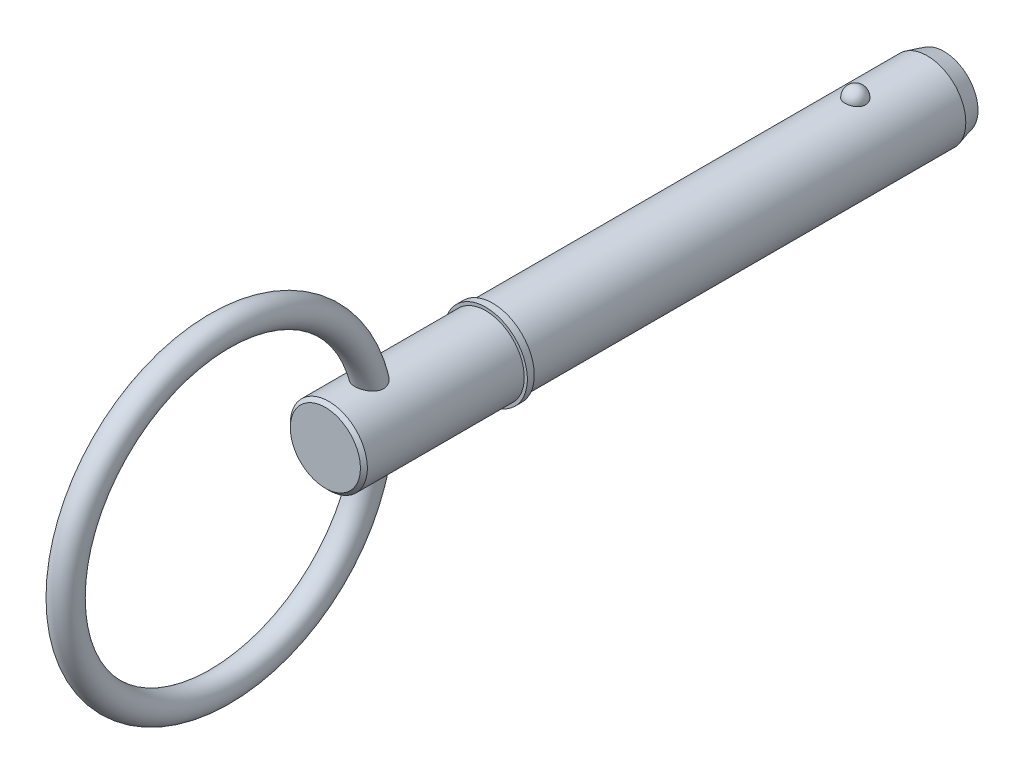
SolidWorks part; units mm, degrees
ref_plane "Front Plane" through (0, 0, 0) normal (0, 0, 1) x (1, 0, 0)
ref_plane "Top Plane" through (0, 0, 0) normal (0, 1, 0) x (1, 0, 0)
ref_plane "Right Plane" through (0, 0, 0) normal (1, 0, 0) x (0, 0, -1)
sketch "Sketch2" plane through (0, 0, 0) normal (0, 0, 1) x (1, 0, 0)
  circle A0 centre (0, 0) radius 5.555
  point P3 (0, 5.555)
  dimension "D1" = 11.11
extrude "Boss-Extrude1" add sketch "Sketch2" along normal blind 50.8
sketch "Sketch3" plane through (0, 0, 0) normal (0, 0, -1) x (-1, 0, 0)
  circle A0 centre (0, 0) radius 5.555
  dimension "D1" = 11.11
extrude "Boss-Extrude2" add sketch "Sketch3" along normal blind 14.27
chamfer "Chamfer1" distance 2.4 angle 15 1 edges at (-5.555, 0, -14.27)
sketch "Sketch18" plane through (0, 0, 0) normal (1, 0, 0) x (0, 0, -1)
  line L0 (11.87, 5.555) -> (-50.8, 5.555) construction
  line L1 (1.49, 7.045) -> (1.49, 4.065)
  line L2 (-50.8, -5.555) -> (11.87, -5.555) construction
  arc A0 (1.49, 7.045) -> (1.49, 4.065) centre (1.49, 5.555) ccw
  point P4 (0, 5.555)
  dimension "D1" = 12.6
revolve "Revolve1" add sketch "Sketch18" angle 360 about L1
sketch "Sketch19" plane through (0, 0, 0) normal (1, 0, 0) x (0, 0, -1)
  line L0 (-33.7288, 0) -> (-46.4542, 0) construction
sketch "Sketch20" plane through (0, 0, 0) normal (1, 0, 0) x (0, 0, -1)
  line L0 (-50.8, 0) -> (-50.8, 6)
  line L1 (-50.8, 5.555) -> (-50.8, -5.555) construction
  line L2 (-50.8, 6) -> (-51.8, 6)
  line L3 (-51.8, 6) -> (-51.8, 0)
  line L4 (-33.7288, 0) -> (-46.4542, 0) construction
  line L5 (-51.8, 0) -> (-50.8, 0)
  dimension "D1" = 6
  dimension "D2" = 1
revolve "Revolve2" add sketch "Sketch20" angle 360 about L0
sketch "Sketch21" plane through (0, 0, 50.8) normal (0, 0, -1) x (-1, 0, 0)
  circle A0 centre (0, 0) radius 5.555
  dimension "D1" = 11.11
extrude "Boss-Extrude3" add sketch "Sketch21" against normal blind 24.13
chamfer "Chamfer2" distance 0.5 angle 45 1 edges at (-5.555, 0, 74.93)
sketch "Sketch23" plane through (0, 0, 0) normal (1, 0, 0) x (0, 0, -1)
  line L0 (-74.93, 5.055) -> (-74.93, -5.055) construction
  circle A0 centre (-90.155, 0) radius 22.225
  point P2 (-67.93, 0)
  dimension "D1" = 44.45
  dimension "D2" = 7
sketch "Sketch24" plane through (0, 0, 0) normal (0, 1, 0) x (1, 0, 0)
  circle A0 centre (0, -67.93) radius 2
  dimension "D1" = 4
sweep "Sweep1" add profiles "Sketch24" path "Sketch23"
